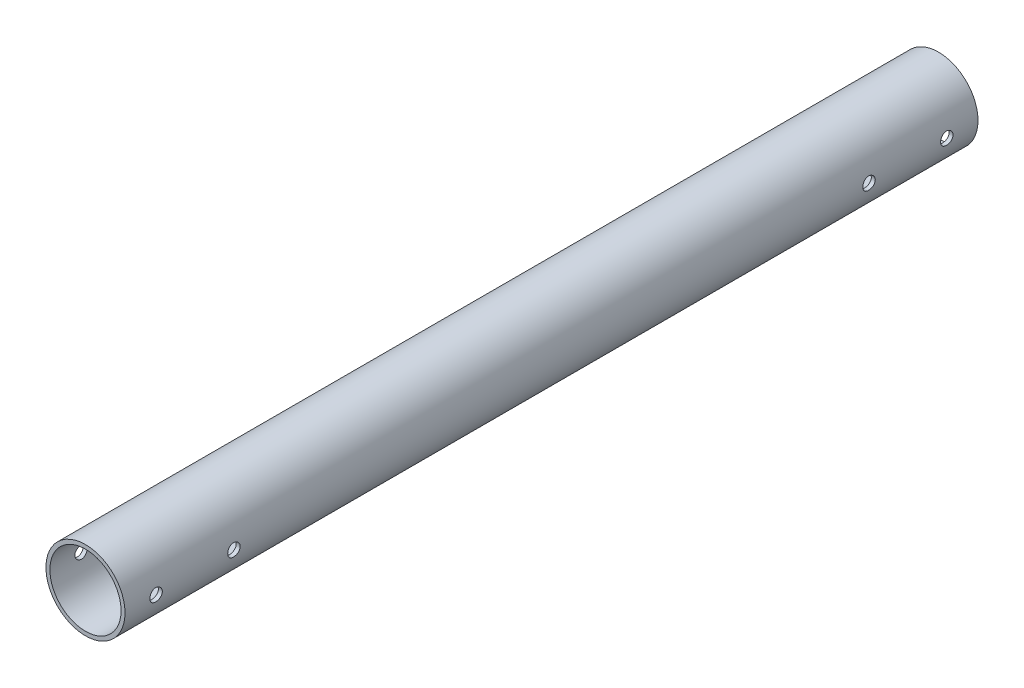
SolidWorks part; units mm, degrees
ref_plane "Front Plane" through (0, 0, 0) normal (1, 0, 0) x (0, 1, 0)
ref_plane "Top Plane" through (0, 0, 0) normal (0, 0, 1) x (0, 1, 0)
ref_plane "Right Plane" through (0, 0, 0) normal (0, 1, 0) x (-1, 0, 0)
sketch "Sketch1" plane through (0, 0, 0) normal (0, 0, 1) x (0, 1, 0)
  circle A0 centre (0, 0) radius 12.7
  circle A1 centre (0, 0) radius 11.43
  dimension "D1" = 25.4
  dimension "D2" = 1.27
extrude "Boss-Extrude1" add sketch "Sketch1" along normal blind 274
sketch "Sketch2" plane through (0, 0, 0) normal (1, 0, 0) x (0, 1, 0)
  line L1 (12.7, 274) -> (-12.7, 274) construction
  circle A0 centre (0, 10) radius 2
  circle A1 centre (0, 35) radius 2
  circle A2 centre (0, 264) radius 2
  circle A3 centre (0, 239) radius 2
  dimension "D1" = 4
  dimension "D2" = 10
  dimension "D3" = 25
  dimension "D4" = 25
  dimension "D5" = 10
extrude "Cut-Extrude2" cut sketch "Sketch2" against normal through all both and the other way through all
